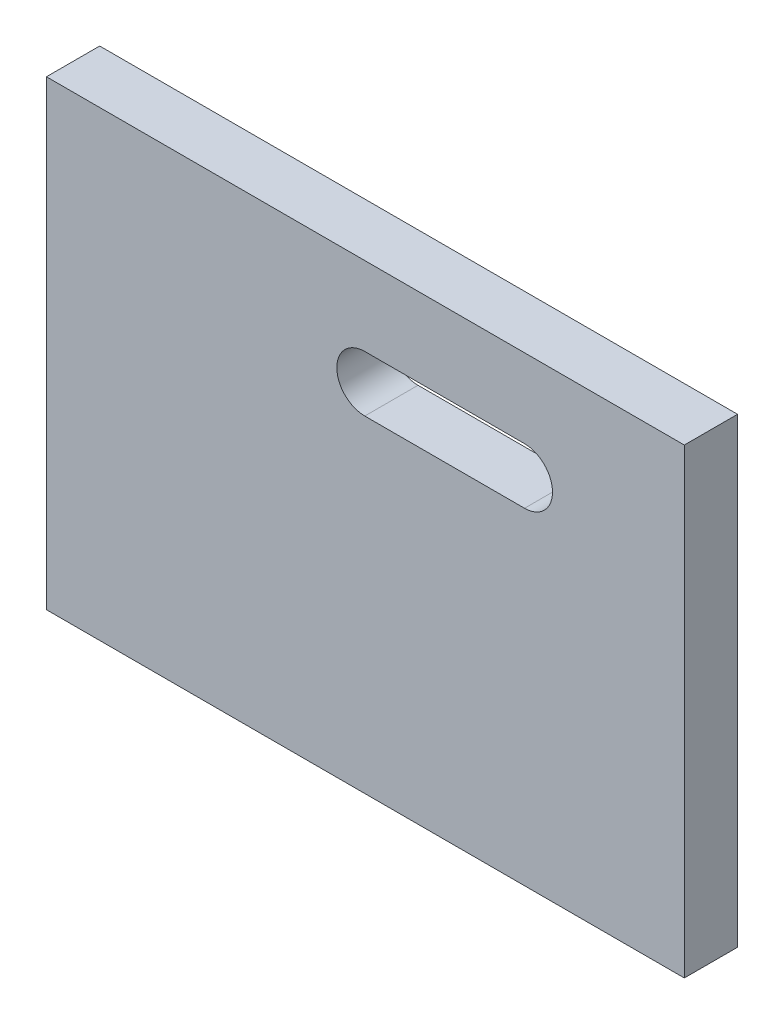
SolidWorks part; units mm, degrees
ref_plane "Ebene vorne" through (0, 0, 0) normal (0, 0, 1) x (1, 0, 0)
ref_plane "Ebene oben" through (0, 0, 0) normal (0, 1, 0) x (1, 0, 0)
ref_plane "Ebene rechts" through (0, 0, 0) normal (1, 0, 0) x (0, 0, -1)
sketch "Skizze1" plane through (0, 0, 0) normal (0, 0, 1) x (1, 0, 0)
  line L0 (18.1315, 30.9123) -> (-11.8685, 30.9123)
  line L1 (-71.6425, 45.6972) -> (48.1315, 45.6972)
  line L2 (-71.6425, 45.6972) -> (-71.6425, -40.9756)
  line L3 (-71.6425, -40.9756) -> (48.1315, -40.9756)
  line L4 (48.1315, 45.6972) -> (48.1315, -40.9756)
  line L5 (-11.8685, 20.4123) -> (18.1315, 20.4123)
  arc A0 (18.1315, 20.4123) -> (18.1315, 30.9123) centre (18.1315, 25.6623) ccw
  arc A1 (-11.8685, 30.9123) -> (-11.8685, 20.4123) centre (-11.8685, 25.6623) ccw
  dimension "D1" = 30
  dimension "D2" = 10.5
  dimension "D3" = 60
extrude "Linear austragen1" add sketch "Skizze1" along normal blind 10
